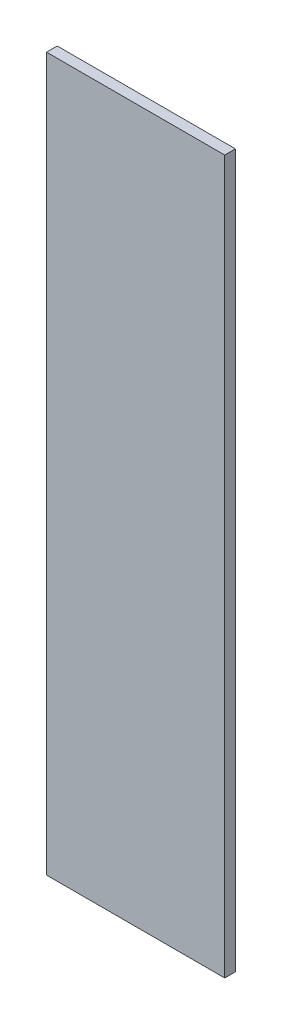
SolidWorks part; units mm, degrees
ref_plane "Front Plane" through (0, 0, 0) normal (0, 0, 1) x (1, 0, 0)
ref_plane "Top Plane" through (0, 0, 0) normal (0, 1, 0) x (1, 0, 0)
ref_plane "Right Plane" through (0, 0, 0) normal (1, 0, 0) x (0, 0, -1)
sketch "Sketch1" plane through (0, 0, 0) normal (0, 0, 1) x (1, 0, 0)
  line L1 (-25, -100) -> (25, -100)
  line L2 (-25, -100) -> (-25, 100)
  line L3 (-25, 100) -> (25, 100)
  line L4 (25, -100) -> (25, 100)
  line L5 (-25, -100) -> (25, 100) construction
  line L6 (-25, 100) -> (25, -100) construction
  point P0 (0, 0)
extrude "Boss-Extrude1" add sketch "Sketch1" along normal blind 3
equation "\"D1@Sketch1\"=200"
equation "\"D2@Sketch1\"=50"
